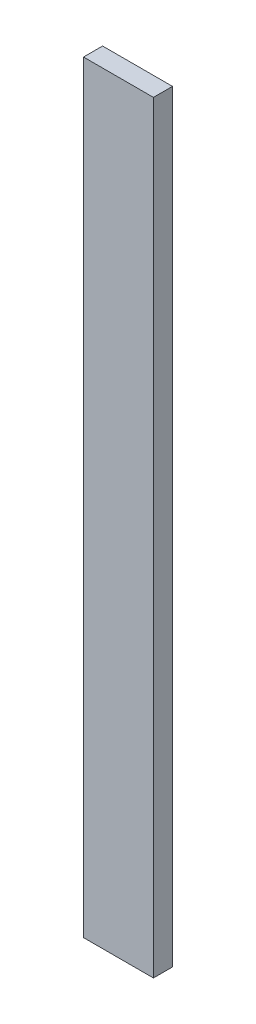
SolidWorks part; units mm, degrees
ref_plane "Front Plane" through (0, 0, 0) normal (0, 0, 1) x (1, 0, 0)
ref_plane "Top Plane" through (0, 0, 0) normal (0, 1, 0) x (1, 0, 0)
ref_plane "Right Plane" through (0, 0, 0) normal (1, 0, 0) x (0, 0, -1)
sketch "Sketch1" plane through (0, 0, 0) normal (0, 1, 0) x (1, 0, 0)
  line L1 (-69.85, 19.05) -> (69.85, 19.05)
  line L2 (-69.85, 19.05) -> (-69.85, -19.05)
  line L3 (-69.85, -19.05) -> (69.85, -19.05)
  line L4 (69.85, 19.05) -> (69.85, -19.05)
  line L5 (-69.85, 19.05) -> (69.85, -19.05) construction
  line L6 (-69.85, -19.05) -> (69.85, 19.05) construction
  point P0 (0, 0)
  dimension "D1" = 139.7
  dimension "D2" = 38.1
extrude "Boss-Extrude1" add sketch "Sketch1" along normal blind 1524
hole_wizard "CSK for #8 Flat Head Machine Screw (100)1" positions "Sketch3" profile "Sketch2" countersink size "#8" standard "ANSI Inch"
sketch "Sketch3" plane through (0, 0, 19.05) normal (0, 0, 1) x (1, 0, 0)
  line L0 (0, 0) -> (0, 1524) construction
  line L1 (-69.85, 0) -> (69.85, 0) construction
  line L2 (-69.85, 1524) -> (69.85, 1524) construction
  line L4 (-44.45, 0) -> (-44.45, 1524) construction
  line L6 (44.45, 1524) -> (44.45, 0) construction
  line L8 (-69.85, 19.05) -> (69.85, 19.05) construction
  line L9 (-69.85, 1524) -> (-69.85, 0) construction
  line L10 (69.85, 1524) -> (69.85, 0) construction
  line L12 (-69.85, 514.35) -> (69.85, 514.35) construction
  line L14 (-69.85, 1009.65) -> (69.85, 1009.65) construction
  line L17 (-69.85, 1504.95) -> (69.85, 1504.95) construction
  point P0 (-44.45, 19.05)
  point P2 (0, 19.05)
  point P4 (44.45, 19.05)
  point P6 (-44.45, 1504.95)
  point P8 (0, 1504.95)
  point P10 (44.45, 1504.95)
  point P12 (-44.45, 1009.65)
  point P14 (0, 1009.65)
  point P16 (44.45, 1009.65)
  point P18 (-44.45, 514.35)
  point P20 (0, 514.35)
  point P22 (44.45, 514.35)
  dimension "D1" = 25.4
  dimension "D2" = 114.3
  dimension "D3" = 19.05
  dimension "D4" = 514.35
  dimension "D5" = 1009.65
  dimension "D6" = 1504.95
sketch "Sketch2" plane through (-44.45, 19.05, 19.05) normal (1, 0, 0) x (0, -1, 0)
  line L0 (0, 0) -> (0, 38.1)
  line L1 (0, 38.1) -> (2.2479, 38.1)
  line L2 (2.2479, 38.1) -> (2.2479, 1.6518)
  line L3 (2.2479, 1.6518) -> (4.2164, 0)
  line L5 (4.2164, 0) -> (0, 0)
  line L6 (-2.2479, 1.6518) -> (-4.2164, 0) construction
  line L11 (0, -6.35) -> (0, 107.95) construction
  dimension "Thru Hole Dia." = 4.4958
  dimension "Thru Hole Depth" = 38.1
  dimension "Near C'Sink Dia." = 8.4328
  dimension "Near C'Sink Angle" = 100
hole_wizard "CSK for #8 Flat Head Machine Screw (100)2" positions "Sketch5" profile "Sketch4" countersink size "#8" standard "ANSI Inch"
sketch "Sketch5" plane through (0, 0, 19.05) normal (0, 0, 1) x (1, 0, 0)
  line L0 (-69.85, 266.7) -> (69.85, 266.7) construction
  line L1 (-69.85, 1524) -> (-69.85, 0) construction
  line L2 (69.85, 1524) -> (69.85, 0) construction
  line L4 (-69.85, 762) -> (69.85, 762) construction
  line L6 (-69.85, 1257.3) -> (69.85, 1257.3) construction
  line L8 (-69.85, 0) -> (69.85, 0) construction
  point P0 (-44.45, 266.7)
  point P2 (0, 266.7)
  point P4 (44.45, 266.7)
  point P6 (-44.45, 762)
  point P8 (0, 762)
  point P10 (44.45, 762)
  point P12 (-44.45, 1257.3)
  point P14 (0, 1257.3)
  point P16 (44.45, 1257.3)
  dimension "D1" = 266.7
  dimension "D2" = 762
  dimension "D3" = 1257.3
sketch "Sketch4" plane through (-44.45, 266.7, 19.05) normal (1, 0, 0) x (0, -1, 0)
  line L0 (0, 0) -> (0, 38.1)
  line L1 (0, 38.1) -> (2.2479, 38.1)
  line L2 (2.2479, 38.1) -> (2.2479, 1.6518)
  line L3 (2.2479, 1.6518) -> (4.2164, 0)
  line L5 (4.2164, 0) -> (0, 0)
  line L6 (-2.2479, 1.6518) -> (-4.2164, 0) construction
  line L11 (0, -6.35) -> (0, 107.95) construction
  dimension "Thru Hole Dia." = 4.4958
  dimension "Thru Hole Depth" = 38.1
  dimension "Near C'Sink Dia." = 8.4328
  dimension "Near C'Sink Angle" = 100
